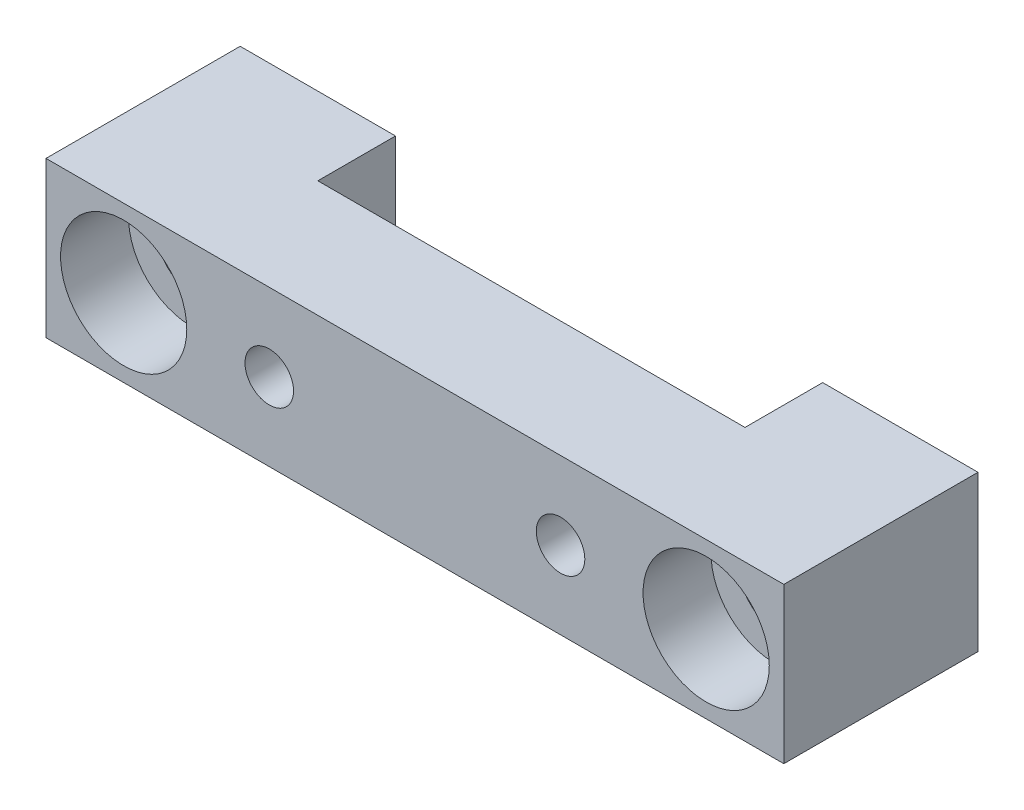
SolidWorks part; units mm, degrees
ref_plane "前视基准面" through (0, 0, 0) normal (0, 0, 1) x (1, 0, 0)
ref_plane "上视基准面" through (0, 0, 0) normal (0, 1, 0) x (1, 0, 0)
ref_plane "右视基准面" through (0, 0, 0) normal (1, 0, 0) x (0, 0, -1)
sketch "草图1" plane through (0, 0, 0) normal (0, 0, 1) x (1, 0, 0)
  line L0 (0, 8) -> (38, 8)
  line L1 (0, 0) -> (38, 0)
  line L2 (38, 0) -> (38, 8)
  line L3 (0, 0) -> (0, 8)
  circle A0 centre (34, 4) radius 1.75
  circle A1 centre (4, 4) radius 1.75
  circle A2 centre (26.5, 4) radius 1.25
  circle A3 centre (11.5, 4) radius 1.25
extrude "凸台-拉伸1" add sketch "草图1" along normal blind 10
sketch "草图2" plane through (0, 0, 10) normal (0, 0, 1) x (1, 0, 0)
  circle A0 centre (34, 4) radius 3.25
  circle A1 centre (4, 4) radius 3.25
extrude "切除-拉伸1" cut sketch "草图2" against normal blind 3.5
sketch "草图3" plane through (0, 8, 0) normal (0, 1, 0) x (1, 0, 0)
  line L0 (8, -4) -> (8, 0)
  line L1 (30, -4) -> (30, 0)
  line L2 (38, -10) -> (38, 0)
  line L3 (0, -10) -> (0, 0)
  line L4 (0, 0) -> (8, 0)
  line L5 (8, -4) -> (30, -4)
  line L6 (0, -10) -> (38, -10)
  line L7 (30, 0) -> (38, 0)
extrude "切除-拉伸2" cut sketch "草图3" against normal through all flip side to cut
